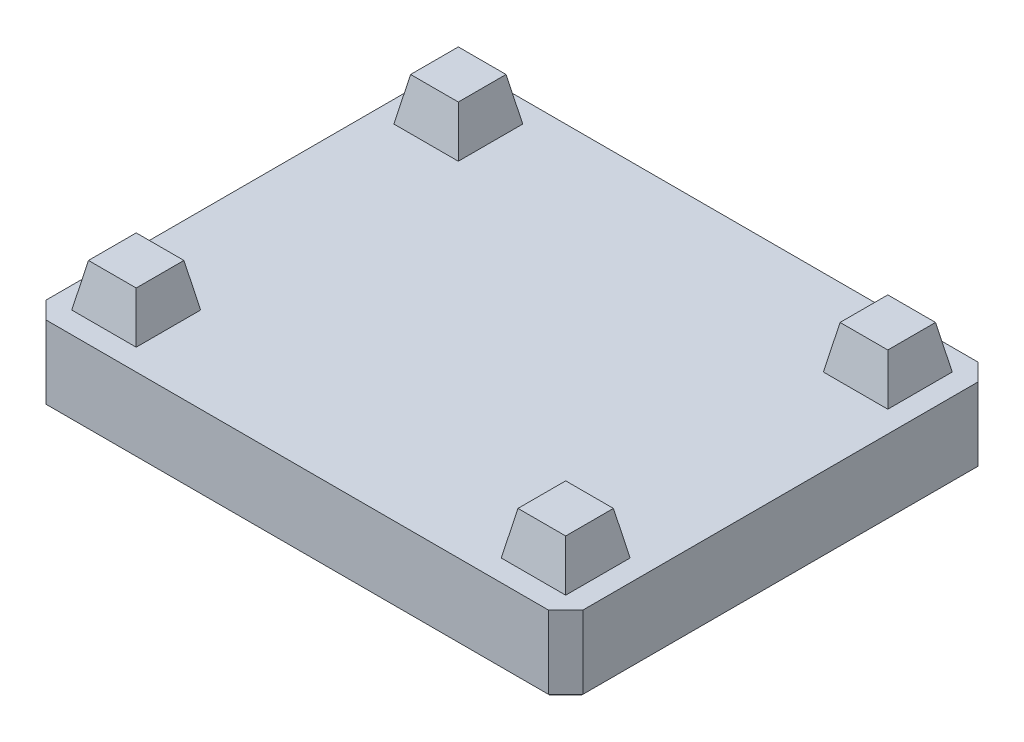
SolidWorks part; units mm, degrees
ref_plane "Face" through (0, 0, 0) normal (0, 0, 1) x (1, 0, 0)
ref_plane "Dessus" through (0, 0, 0) normal (0, 1, 0) x (1, 0, 0)
ref_plane "Droite" through (0, 0, 0) normal (1, 0, 0) x (0, 0, -1)
sketch "Esquisse1" plane through (0, 0, 0) normal (0, 0, 1) x (1, 0, 0)
  line L1 (0, 0) -> (250, 0)
  line L2 (0, 0) -> (0, 35)
  line L3 (0, 35) -> (250, 35)
  line L4 (250, 0) -> (250, 35)
  dimension "D1" = 250
  dimension "D2" = 35
extrude "Extrusion1" add sketch "Esquisse1" along normal blind 200
chamfer "Chanfrein1" distance 8 angle 45
chamfer "Chanfrein2" distance 1 angle 45
sketch "Esquisse2" plane through (0, 35, 0) normal (0, 1, 0) x (-1, 0, 0)
  line L0 (-250, 192) -> (-250, 8) construction
  line L1 (-240, 10) -> (-210, 10)
  line L2 (-240, 10) -> (-240, 40)
  line L3 (-240, 40) -> (-210, 40)
  line L4 (-210, 10) -> (-210, 40)
  line L5 (-242, 0) -> (-8, 0) construction
  dimension "D1" = 10
  dimension "D2" = 10
  dimension "D3" = 30
  dimension "D4" = 30
extrude "Extrusion2" add sketch "Esquisse2" along normal blind 20 draft 11
pattern_linear "Répétition linéaire1" count 2 spacing 150 count 2 spacing 200
